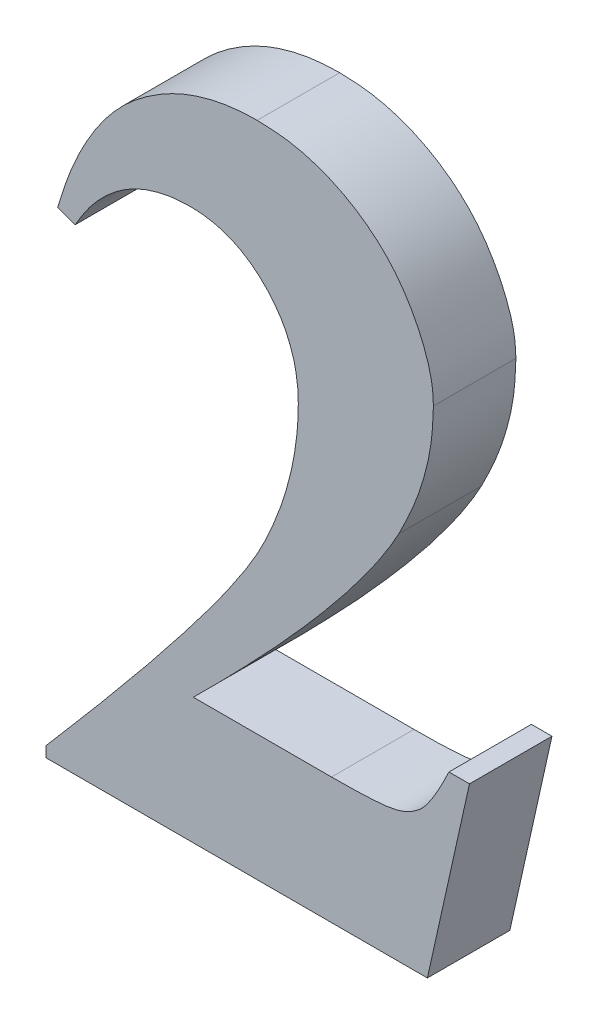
SolidWorks part; units mm, degrees
ref_plane "Front" through (0, 0, 0) normal (0, 0, 1) x (1, 0, 0)
ref_plane "Top" through (0, 0, 0) normal (0, 1, 0) x (1, 0, 0)
ref_plane "Right" through (0, 0, 0) normal (1, 0, 0) x (0, 0, -1)
sketch "Sketch2" plane through (0, 0, 0) normal (0, 0, 1) x (1, 0, 0)
  line L1 (-28.575, 57.15) -> (28.575, 57.15)
  line L2 (-28.575, 57.15) -> (-28.575, 0)
  line L3 (-28.575, 0) -> (28.575, 0)
  line L4 (28.575, 57.15) -> (28.575, 0)
  dimension "D1" = 57.15
  dimension "D2" = 57.15
extrude "Base-Extrude" add sketch "Sketch2" against normal blind 6.35
sketch "Sketch4" plane through (0, 0, 0) normal (0, 0, 1) x (1, 0, 0)
  text T0 "2" font "Times New Roman" height 50.8
extrude "Cut-Extrude1" cut sketch "Sketch4" against normal through all flip side to cut
